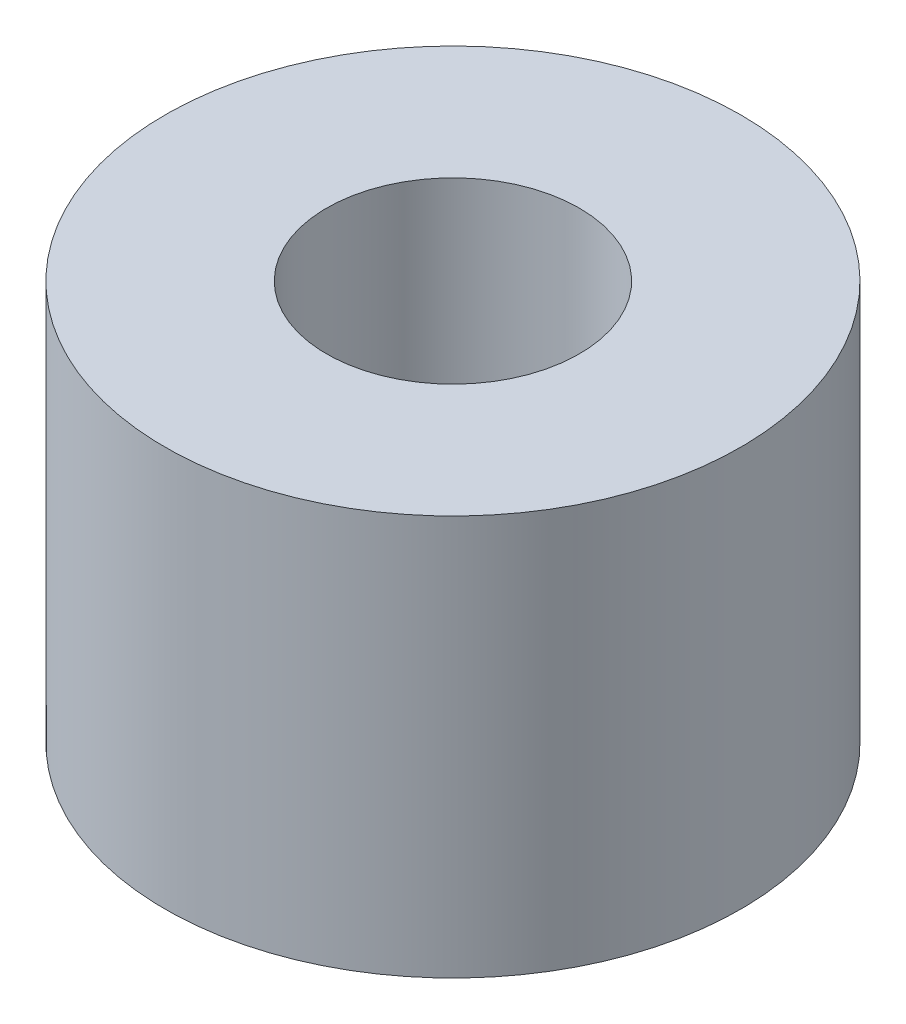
SolidWorks part; units mm, degrees
ref_plane "Face" through (0, 0, 0) normal (0, 0, 1) x (1, 0, 0)
ref_plane "Dessus" through (0, 0, 0) normal (0, 1, 0) x (1, 0, 0)
ref_plane "Droite" through (0, 0, 0) normal (1, 0, 0) x (0, 0, -1)
sketch "Esquisse1" plane through (0, 0, 0) normal (0, 0, 1) x (1, 0, 0)
  line L0 (0, 0) -> (0, 100.2905) construction
  line L1 (-82, 114) -> (-36, 114)
  line L2 (-36, 114) -> (-36, 0)
  line L3 (-36, 0) -> (-82, 0)
  line L4 (-82, 0) -> (-82, 114)
  dimension "D1" = 72
  dimension "D2" = 164
  dimension "D3" = 114
revolve "Révolution1" add sketch "Esquisse1" angle 360 about L0
